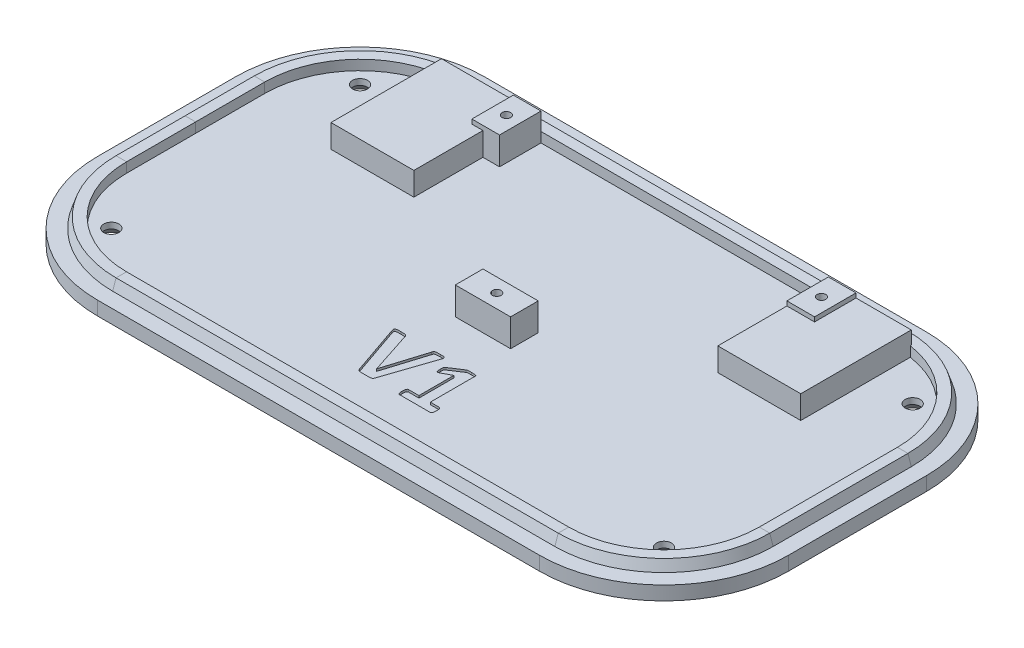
SolidWorks part; units mm, degrees
ref_plane "Plane XZ" through (0, 0, 0) normal (0, 0, 1) x (1, 0, 0)
ref_plane "Plane XY" through (0, 0, 0) normal (0, 1, 0) x (1, 0, 0)
ref_plane "Plane YZ" through (0, 0, 0) normal (1, 0, 0) x (0, 0, -1)
sketch "Sketch1" plane through (0, 0, 0) normal (0, 1, 0) x (1, 0, 0)
  line L0 (0, 44.45) -> (0, -44.45) construction
  line L1 (-79.375, 44.45) -> (79.375, 44.45)
  line L2 (-79.375, 44.45) -> (-79.375, -44.45)
  line L3 (-79.375, -44.45) -> (79.375, -44.45)
  line L4 (79.375, 44.45) -> (79.375, -44.45)
  dimension "D1" = 88.9
  dimension "D2" = 158.75
extrude "Boss-Extrude1" add sketch "Sketch1" along normal blind 3.175
fillet "Fillet1" radius 28.575 4 edges at (-79.375, 1.5875, -44.45) (-79.375, 1.5875, 44.45) (79.375, 1.5875, -44.45) (79.375, 1.5875, 44.45)
sketch "Sketch2" plane through (0, 3.175, 0) normal (0, 1, 0) x (1, 0, 0)
  line L8 (50.8, 40.95) -> (-50.8, 40.95)
  line L9 (-75.875, 15.875) -> (-75.875, -15.875)
  line L10 (-50.8, -40.95) -> (50.8, -40.95)
  line L11 (75.875, -15.875) -> (75.875, 15.875)
  line L12 (50.8, 40.95) -> (-50.8, 40.95)
  line L13 (-75.875, 15.875) -> (-75.875, -15.875)
  line L14 (-50.8, -40.95) -> (50.8, -40.95)
  line L15 (75.875, -15.875) -> (75.875, 15.875)
  arc A8 (-50.8, 40.95) -> (-75.875, 15.875) centre (-50.8, 15.875) ccw
  arc A9 (-75.875, -15.875) -> (-50.8, -40.95) centre (-50.8, -15.875) ccw
  arc A10 (50.8, -40.95) -> (75.875, -15.875) centre (50.8, -15.875) ccw
  arc A11 (75.875, 15.875) -> (50.8, 40.95) centre (50.8, 15.875) ccw
  arc A12 (-50.8, 40.95) -> (-75.875, 15.875) centre (-50.8, 15.875) ccw
  arc A13 (-75.875, -15.875) -> (-50.8, -40.95) centre (-50.8, -15.875) ccw
  arc A14 (50.8, -40.95) -> (75.875, -15.875) centre (50.8, -15.875) ccw
  arc A15 (75.875, 15.875) -> (50.8, 40.95) centre (50.8, 15.875) ccw
  dimension "D1" = 3.5
sketch "Sketch3" plane through (0, 0, 0) normal (0, 0, 1) x (1, 0, 0)
  line L0 (-75.875, 3.175) -> (-75.113, 5.461)
  line L1 (-75.113, 5.461) -> (-72.7, 5.461)
  line L2 (-72.7, 5.461) -> (-72.7, 3.175)
  line L3 (-72.7, 3.175) -> (-75.875, 3.175)
  line L4 (0, -28.1241) -> (0, 22.1208) construction
  dimension "D1" = 18.435
  dimension "D2" = 3.175
  dimension "D3" = 2.286
sweep "Sweep1" add profiles "Sketch3" path "Sketch2"
sketch "Sketch4" plane through (0, 3.175, 0) normal (0, 1, 0) x (1, 0, 0)
  line L0 (0, 28.575) -> (0, -28.575) construction
  line L1 (-63.5, 28.575) -> (63.5, 28.575) construction
  line L2 (-63.5, 28.575) -> (-63.5, -28.575) construction
  line L3 (-63.5, -28.575) -> (63.5, -28.575) construction
  line L4 (63.5, 28.575) -> (63.5, -28.575) construction
  line L5 (-71.0056, 36.0806) -> (-50.8, 15.875) construction
  arc A0 (-50.8, 44.45) -> (-79.375, 15.875) centre (-50.8, 15.875) ccw construction
  circle A1 centre (-63.5, 28.575) radius 3.175 construction
  circle A2 centre (-63.5, 28.575) radius 1.5875
  circle A3 centre (63.5, 28.575) radius 1.5875
  circle A4 centre (-63.5, -28.575) radius 1.5875
  circle A5 centre (63.5, -28.575) radius 1.5875
  dimension "D1" = 6.35
  dimension "D4" = 3.175
  dimension "D2" = 127
  dimension "D3" = 57.15
extrude "Cut-Extrude1" cut sketch "Sketch4" against normal through all
sketch "Sketch5" plane through (0, 0, 0) normal (0, -1, 0) x (1, 0, 0)
  line L0 (-44.45, -37.775) -> (-44.45, -12.375) construction
  line L5 (-34.925, -37.775) -> (-53.975, -37.775)
  line L6 (-34.925, -37.775) -> (-34.925, -12.375)
  line L7 (-34.925, -12.375) -> (-53.975, -12.375)
  line L8 (-53.975, -37.775) -> (-53.975, -12.375)
  line L9 (0, -44.45) -> (0, 44.45) construction
  line L10 (50.8, -44.45) -> (-50.8, -44.45) construction
  line L11 (-50.8, 44.45) -> (50.8, 44.45) construction
  line L12 (-50.8, -37.775) -> (50.8, -37.775) construction
  line L13 (34.925, -37.775) -> (34.925, -12.375)
  line L14 (34.925, -37.775) -> (53.975, -37.775)
  line L15 (53.975, -37.775) -> (53.975, -12.375)
  line L16 (34.925, -12.375) -> (53.975, -12.375)
  dimension "D1" = 19.05
  dimension "D2" = 25.4
  dimension "D3" = 44.45
extrude "Boss-Extrude2" add sketch "Sketch5" against normal blind 8.509
sketch "Sketch6" plane through (0, 0, 0) normal (0, -1, 0) x (1, 0, 0)
  line L0 (-44.45, -37.775) -> (-44.45, -12.375) construction
  line L1 (-42.2275, -29.52) -> (-42.2275, -25.198)
  line L2 (-46.6725, -29.52) -> (-46.6725, -25.198)
  line L3 (-44.45, -29.52) -> (-44.45, -20.63) construction
  line L4 (0, -44.45) -> (0, 44.45) construction
  line L5 (50.8, -44.45) -> (-50.8, -44.45) construction
  line L6 (-50.8, 44.45) -> (50.8, 44.45) construction
  line L7 (42.2275, -29.52) -> (42.2275, -25.198)
  line L8 (46.6725, -29.52) -> (46.6725, -25.198)
  circle A0 centre (-44.45, -20.63) radius 5.08 construction
  circle A1 centre (-44.45, -29.52) radius 2.2225 construction
  arc A2 (-42.2275, -25.198) -> (-46.6725, -25.198) centre (-44.45, -20.63) ccw
  arc A3 (-42.2275, -29.52) -> (-46.6725, -29.52) centre (-44.45, -29.52) cw
  arc A4 (42.2275, -25.198) -> (46.6725, -25.198) centre (44.45, -20.63) cw
  arc A5 (42.2275, -29.52) -> (46.6725, -29.52) centre (44.45, -29.52) ccw
  point P12 (-44.45, -25.075)
  dimension "D1" = 10.16
  dimension "D2" = 4.445
  dimension "D3" = 8.89
extrude "Cut-Extrude2" cut sketch "Sketch6" against normal blind 3.175
sketch "Sketch7" plane through (0, 3.175, 0) normal (0, -1, 0) x (1, 0, 0)
  line L0 (44.45, -20.63) -> (44.45, -29.52) construction
  line L1 (49.53, -20.63) -> (49.53, -29.52)
  line L2 (39.37, -20.63) -> (39.37, -29.52)
  line L3 (0, -44.45) -> (0, 44.45) construction
  line L4 (50.8, -44.45) -> (-50.8, -44.45) construction
  line L5 (-50.8, 44.45) -> (50.8, 44.45) construction
  line L6 (-44.45, -20.63) -> (-44.45, -29.52) construction
  line L7 (-49.53, -20.63) -> (-49.53, -29.52)
  line L8 (-39.37, -20.63) -> (-39.37, -29.52)
  arc A0 (49.53, -20.63) -> (39.37, -20.63) centre (44.45, -20.63) ccw
  arc A1 (39.37, -29.52) -> (49.53, -29.52) centre (44.45, -29.52) ccw
  arc A2 (46.6725, -25.198) -> (42.2275, -25.198) centre (44.45, -20.63) ccw construction
  arc A3 (42.2275, -29.52) -> (46.6725, -29.52) centre (44.45, -29.52) ccw construction
  arc A4 (-49.53, -20.63) -> (-39.37, -20.63) centre (-44.45, -20.63) cw
  arc A5 (-39.37, -29.52) -> (-49.53, -29.52) centre (-44.45, -29.52) cw
  point P2 (44.45, -25.075)
  point P22 (-44.45, -25.075)
extrude "Cut-Extrude3" cut sketch "Sketch7" against normal blind 3.81
sketch "Sketch8" plane through (0, 3.175, 0) normal (0, 1, 0) x (1, 0, 0)
  line L0 (0, 0) -> (0, -0.325) construction
  line L1 (-6.35, -0.325) -> (6.35, -0.325)
  line L2 (-6.35, -0.325) -> (-6.35, -6.675)
  line L3 (-6.35, -6.675) -> (6.35, -6.675)
  line L4 (6.35, -0.325) -> (6.35, -6.675)
  line L5 (-34.925, 37.775) -> (34.925, 37.775) construction
  dimension "D1" = 38.1
  dimension "D2" = 6.35
  dimension "D3" = 12.7
extrude "Boss-Extrude3" add sketch "Sketch8" along normal blind 6.35
sketch "1200 mAh Battery Outline" plane through (0, 3.175, 0) normal (0, 1, 0) x (1, 0, 0)
  line L0 (34.925, 37.775) -> (34.925, 12.375) construction
  line L1 (-28.575, 35.235) -> (32.385, 35.235)
  line L2 (-28.575, 35.235) -> (-28.575, 2.215)
  line L3 (-28.575, 2.215) -> (32.385, 2.215)
  line L4 (32.385, 35.235) -> (32.385, 2.215)
  line L5 (-34.925, 37.775) -> (34.925, 37.775) construction
  dimension "D1" = 33.02
  dimension "D2" = 60.96
  dimension "D3" = 2.54
  dimension "D4" = 2.54
sketch "Sketch10" plane through (0, 9.525, 0) normal (0, 1, 0) x (1, 0, 0)
  line L0 (-31.115, 37.775) -> (-31.115, 28.25)
  line L1 (-31.115, 28.25) -> (-37.465, 28.25)
  line L2 (-37.465, 28.25) -> (-37.465, 37.775)
  line L3 (-37.465, 37.775) -> (-31.115, 37.775)
  line L4 (-53.975, 37.775) -> (-34.925, 37.775) construction
  line L5 (34.925, 37.775) -> (41.275, 37.775)
  line L6 (34.925, 37.775) -> (34.925, 28.25)
  line L7 (34.925, 28.25) -> (41.275, 28.25)
  line L8 (41.275, 37.775) -> (41.275, 28.25)
  line L9 (-28.575, 35.235) -> (-28.575, 2.215) construction
  dimension "D1" = 2.54
  dimension "D2" = 9.525
  dimension "D3" = 6.35
extrude "Boss-Extrude4" add sketch "Sketch10" against normal up to next
sketch "Sketch11" plane through (0, 9.525, 0) normal (0, 1, 0) x (1, 0, 0)
  line L0 (-37.465, 33.0125) -> (-31.115, 33.0125) construction
  line L1 (-34.29, 33.0125) -> (38.1, 33.0125) construction
  line L2 (-34.29, 33.0125) -> (-34.29, -3.5) construction
  line L3 (-34.29, -3.5) -> (38.1, -3.5) construction
  line L4 (38.1, 33.0125) -> (38.1, -3.5) construction
  line L5 (-37.465, 37.775) -> (-37.465, 28.25) construction
  line L6 (-31.115, 28.25) -> (-31.115, 37.775) construction
  line L7 (34.925, 33.0125) -> (41.275, 33.0125) construction
  line L8 (34.925, 37.775) -> (34.925, 28.25) construction
  line L9 (41.275, 28.25) -> (41.275, 37.775) construction
  line L10 (0, -0.325) -> (0, -6.675) construction
  line L11 (6.35, -0.325) -> (-6.35, -0.325) construction
  line L12 (-6.35, -6.675) -> (6.35, -6.675) construction
  circle A0 centre (-34.29, 33.0125) radius 0.9906
  circle A1 centre (0, -3.5) radius 0.9906
  circle A2 centre (38.1, 33.0125) radius 0.9906
  point P22 (0, -3.5)
  dimension "D5" = 1.9812
  dimension "D1" = 72.39
  dimension "D2" = 36.5125
  dimension "D3" = 34.29
  dimension "D4" = 38.1
extrude "Cut-Extrude4" cut sketch "Sketch11" against normal up to surface (6.35 mm away)
hole_wizard "CSK for #4 Flat Head Machine Screw1" positions "Sketch12" profile "Sketch13" countersink size "#4" standard "ANSI Inch"
sketch "Sketch12" plane through (0, 0, 0) normal (0, -1, 0) x (-1, 0, 0)
  circle A0 centre (63.5, 28.575) radius 1.5875 construction
  point P0 (-63.5, 28.575)
  point P3 (-63.5, -28.575)
  point P6 (63.5, -28.575)
  point P9 (63.5, 28.575)
sketch "Sketch13" plane through (63.5, 0, -28.575) normal (1, 0, 0) x (0, 0, -1)
  line L0 (0, 0) -> (0, 9.525)
  line L1 (0, 9.525) -> (1.7272, 9.525)
  line L2 (1.7272, 9.525) -> (1.7272, 1.8083)
  line L3 (1.7272, 1.8083) -> (3.2991, 0)
  line L5 (3.2991, 0) -> (0, 0)
  line L6 (-1.7272, 1.8083) -> (-3.2991, 0) construction
  line L11 (0, -6.35) -> (0, 107.95) construction
  dimension "Thru Hole Dia." = 3.4544
  dimension "Thru Hole Depth" = 9.525
  dimension "Near C'Sink Dia." = 6.5982
  dimension "Near C'Sink Angle" = 82
sketch "Sketch14" plane through (0, 3.175, 0) normal (0, 1, 0) x (1, 0, 0)
  line L0 (0, 0) -> (0, -28.575) construction
  line L1 (-19.8909, -28.575) -> (19.8909, -28.575) construction
  text T0 "V1" font "Calibri" height 12.7
  dimension "D1" = 28.575
extrude "Cut-Extrude5" cut sketch "Sketch14" against normal blind 0.508
